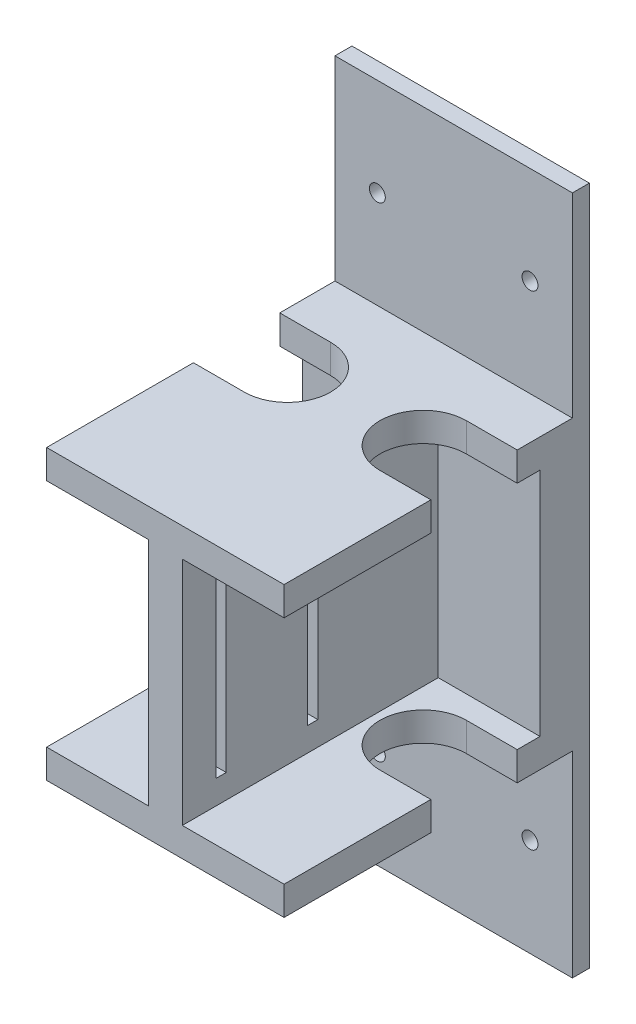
SolidWorks part; units mm, degrees
ref_plane "Front Plane" through (0, 0, 0) normal (0, 0, 1) x (1, 0, 0)
ref_plane "Top Plane" through (0, 0, 0) normal (0, 1, 0) x (1, 0, 0)
ref_plane "Right Plane" through (0, 0, 0) normal (1, 0, 0) x (0, 0, -1)
sketch "Sketch1" plane through (0, 0, 0) normal (0, 0, 1) x (1, 0, 0)
  line L1 (-17.78, 21.59) -> (17.78, 21.59)
  line L2 (-17.78, 21.59) -> (-17.78, -21.59)
  line L3 (-17.78, -21.59) -> (17.78, -21.59)
  line L4 (17.78, 21.59) -> (17.78, -21.59)
  line L5 (-17.78, 21.59) -> (17.78, -21.59) construction
  line L6 (-17.78, -21.59) -> (17.78, 21.59) construction
  point P0 (0, 0)
  dimension "D1" = 35.56
  dimension "D2" = 43.18
extrude "Boss-Extrude1" add sketch "Sketch1" along normal blind 45.72
sketch "Sketch2" plane through (17.78, 0, 0) normal (1, 0, 0) x (0, 0, -1)
  line L0 (-45.72, -21.59) -> (-45.72, 21.59) construction
  line L1 (-45.72, 17.272) -> (-7.3914, 17.272)
  line L2 (-45.72, 17.272) -> (-45.72, -17.272)
  line L3 (-45.72, -17.272) -> (-7.3914, -17.272)
  line L4 (-7.3914, 17.272) -> (-7.3914, -17.272)
  line L5 (-45.72, 17.272) -> (-7.3914, -17.272) construction
  line L6 (-45.72, -17.272) -> (-7.3914, 17.272) construction
  line L8 (-45.72, -21.59) -> (0, -21.59) construction
  point P4 (-26.5557, 0)
  dimension "D1" = 34.544
  dimension "D2" = 38.3286
  dimension "D3" = 21.59
extrude "Cut-Extrude1" cut sketch "Sketch2" against normal blind 15.24
sketch "Sketch4" plane through (-17.78, 0, 0) normal (-1, 0, 0) x (0, 0, 1)
  line L0 (45.72, 21.59) -> (45.72, -21.59) construction
  line L1 (7.3914, 17.272) -> (45.72, 17.272)
  line L2 (7.3914, 17.272) -> (7.3914, -17.272)
  line L3 (7.3914, -17.272) -> (45.72, -17.272)
  line L4 (45.72, 17.272) -> (45.72, -17.272)
  line L5 (7.3914, 17.272) -> (45.72, -17.272) construction
  line L6 (7.3914, -17.272) -> (45.72, 17.272) construction
  line L7 (45.72, -21.59) -> (0, -21.59) construction
  point P0 (26.5557, 0)
  dimension "D1" = 34.544
  dimension "D2" = 38.3286
  dimension "D3" = 21.59
extrude "Cut-Extrude2" cut sketch "Sketch4" against normal blind 15.24
sketch "Sketch5" plane through (0, 21.59, 0) normal (0, 1, 0) x (1, 0, 0)
  line L0 (-10.16, -17.272) -> (10.16, -17.272) construction
  line L1 (-17.78, -45.72) -> (-17.78, 0) construction
  line L2 (17.78, -45.72) -> (17.78, 0) construction
  line L3 (17.78, -45.72) -> (-17.78, -45.72) construction
  line L4 (-10.16, -45.72) -> (-10.16, -17.272) construction
  line L5 (10.16, -45.72) -> (10.16, -17.272) construction
  line L7 (-17.78, -10.8077) -> (-10.16, -10.8077)
  line L8 (-17.78, -10.8077) -> (-17.78, -23.7363)
  line L9 (-17.78, -23.7363) -> (-10.16, -23.7363)
  line L10 (-10.16, -10.8077) -> (-10.16, -23.7363)
  line L11 (-17.78, -10.8077) -> (-10.16, -23.7363) construction
  line L12 (-17.78, -23.7363) -> (-10.16, -10.8077) construction
  line L13 (10.16, -10.8077) -> (17.78, -10.8077)
  line L14 (10.16, -10.8077) -> (10.16, -23.7363)
  line L15 (10.16, -23.7363) -> (17.78, -23.7363)
  line L16 (17.78, -10.8077) -> (17.78, -23.7363)
  line L17 (10.16, -10.8077) -> (17.78, -23.7363) construction
  line L18 (10.16, -23.7363) -> (17.78, -10.8077) construction
  circle A0 centre (-10.16, -17.272) radius 6.4643
  circle A1 centre (10.16, -17.272) radius 6.4643
  point P17 (-13.97, -17.272)
  point P21 (13.97, -17.272)
  dimension "D2" = 12.9286
  dimension "D3" = 12.9286
  dimension "D1" = 28.448
  dimension "D4" = 7.62
  dimension "D5" = 7.62
  dimension "D6" = 12.9286
  dimension "D7" = 7.62
  dimension "D8" = 28.448
  dimension "D9" = 12.9286
  dimension "D10" = 7.62
  dimension "D11" = 28.448
extrude "Cut-Extrude6" cut sketch "Sketch5" against normal through all contours A0 L7 L9 M3 | L10 A0 | L10 A0 | L14 A1 | L14 A1 | A1 L15 L13 M5
sketch "Sketch7" plane through (0, 21.59, 0) normal (0, 1, 0) x (1, 0, 0)
  line L0 (17.78, 0) -> (-17.78, 0) construction
  line L1 (-17.78, 0) -> (17.78, 0)
  line L2 (-17.78, 0) -> (-17.78, -2.54)
  line L3 (-17.78, -2.54) -> (17.78, -2.54)
  line L4 (17.78, 0) -> (17.78, -2.54)
  line L5 (-17.78, 0) -> (17.78, -2.54) construction
  line L6 (-17.78, -2.54) -> (17.78, 0) construction
  line L7 (-17.78, -10.8077) -> (-17.78, 0) construction
  line L8 (17.78, -10.8077) -> (17.78, 0) construction
  point P4 (0, -1.27)
  dimension "D1" = 2.54
extrude "Boss-Extrude2" add sketch "Sketch7" along normal blind 29.21 and the other way blind 72.6186
sketch "Sketch12" plane through (0, 0, 2.54) normal (0, 0, 1) x (1, 0, 0)
  line L0 (-17.78, 36.195) -> (17.78, 36.195) construction
  line L1 (-17.78, 21.59) -> (-17.78, 50.8) construction
  line L2 (17.78, 21.59) -> (17.78, 50.8) construction
  circle A0 centre (-11.43, 36.195) radius 1.1906
  circle A1 centre (11.43, 36.195) radius 1.1906
  dimension "D1" = 2.3813
  dimension "D2" = 2.3813
  dimension "D3" = 6.35
  dimension "D4" = 6.35
extrude "Cut-Extrude7" cut sketch "Sketch12" against normal through all
sketch "Sketch16" plane through (0, 0, 2.54) normal (0, 0, 1) x (1, 0, 0)
  line L0 (-17.78, -36.3093) -> (17.78, -36.3093) construction
  line L1 (-17.78, -51.0286) -> (-17.78, -21.59) construction
  line L2 (17.78, -51.0286) -> (17.78, -21.59) construction
  circle A0 centre (-11.43, -36.3093) radius 1.1906
  circle A1 centre (11.43, -36.3093) radius 1.1906
  dimension "D1" = 2.3813
  dimension "D2" = 2.3813
  dimension "D3" = 6.35
  dimension "D4" = 6.35
extrude "Cut-Extrude8" cut sketch "Sketch16" against normal through all
sketch "Sketch18" plane through (-2.54, 0, 0) normal (-1, 0, 0) x (0, 0, 1)
  line L0 (45.72, 0) -> (20.32, 0) construction
  line L1 (25.4254, 13.6906) -> (26.9494, 13.6906)
  line L2 (25.4254, 13.6906) -> (25.4254, -13.6906)
  line L3 (25.4254, -13.6906) -> (26.9494, -13.6906)
  line L4 (26.9494, 13.6906) -> (26.9494, -13.6906)
  line L5 (25.4254, 13.6906) -> (26.9494, -13.6906) construction
  line L6 (25.4254, -13.6906) -> (26.9494, 13.6906) construction
  line L7 (45.72, -17.272) -> (45.72, 17.272) construction
  line L9 (7.3914, 17.272) -> (7.3914, -17.272) construction
  line L10 (7.3914, 17.272) -> (7.3914, -17.272) construction
  line L11 (34.1884, 13.6906) -> (32.6644, 13.6906)
  line L12 (34.1884, 13.6906) -> (34.1884, -13.6906)
  line L13 (34.1884, -13.6906) -> (32.6644, -13.6906)
  line L14 (32.6644, 13.6906) -> (32.6644, -13.6906)
  line L15 (34.1884, 13.6906) -> (32.6644, -13.6906) construction
  line L16 (34.1884, -13.6906) -> (32.6644, 13.6906) construction
  line L19 (39.5986, 13.6906) -> (41.1226, 13.6906)
  line L20 (39.5986, 13.6906) -> (39.5986, -13.6906)
  line L21 (39.5986, -13.6906) -> (41.1226, -13.6906)
  line L22 (41.1226, 13.6906) -> (41.1226, -13.6906)
  line L23 (39.5986, 13.6906) -> (41.1226, -13.6906) construction
  line L24 (39.5986, -13.6906) -> (41.1226, 13.6906) construction
  point P4 (26.1874, 0)
  point P17 (33.4264, 0)
  point P27 (40.3606, 0)
  dimension "D1" = 1.524
  dimension "D2" = 27.3812
  dimension "D3" = 18.034
  dimension "D4" = 25.4
  dimension "D5" = 1.524
  dimension "D6" = 27.3812
  dimension "D7" = 25.273
  dimension "D8" = 1.524
  dimension "D9" = 27.3812
  dimension "D10" = 32.2072
extrude "Cut-Extrude9" cut sketch "Sketch18" against normal blind 1.524
sketch "Sketch19" plane through (2.54, 0, 0) normal (1, 0, 0) x (0, 0, -1)
  line L0 (-7.3914, -17.272) -> (-7.3914, 17.272) construction
  line L1 (-26.9494, 13.6906) -> (-25.4254, 13.6906)
  line L2 (-26.9494, 13.6906) -> (-26.9494, -13.6906)
  line L3 (-26.9494, -13.6906) -> (-25.4254, -13.6906)
  line L4 (-25.4254, 13.6906) -> (-25.4254, -13.6906)
  line L5 (-26.9494, 13.6906) -> (-25.4254, -13.6906) construction
  line L6 (-26.9494, -13.6906) -> (-25.4254, 13.6906) construction
  line L7 (-45.72, 0) -> (-20.32, 0) construction
  line L10 (-45.72, 17.272) -> (-45.72, -17.272) construction
  line L12 (-40.6654, 13.6906) -> (-39.1414, 13.6906)
  line L13 (-40.6654, 13.6906) -> (-40.6654, -13.6906)
  line L14 (-40.6654, -13.6906) -> (-39.1414, -13.6906)
  line L15 (-39.1414, 13.6906) -> (-39.1414, -13.6906)
  line L16 (-40.6654, 13.6906) -> (-39.1414, -13.6906) construction
  line L17 (-40.6654, -13.6906) -> (-39.1414, 13.6906) construction
  point P4 (-26.1874, 0)
  point P17 (-39.9034, 0)
  dimension "D1" = 1.524
  dimension "D2" = 27.3812
  dimension "D3" = 18.034
  dimension "D4" = 25.4
  dimension "D5" = 1.524
  dimension "D6" = 27.3812
  dimension "D7" = 31.75
extrude "Cut-Extrude10" cut sketch "Sketch19" against normal blind 1.524
